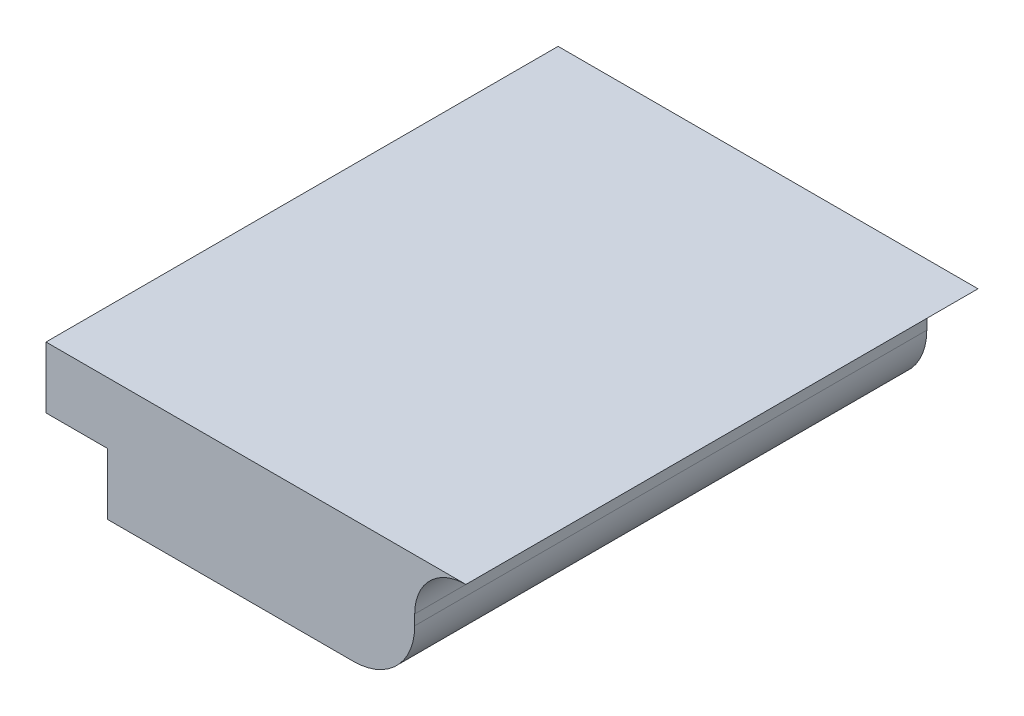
SolidWorks part; units mm, degrees
ref_plane "Plane1" through (0, 0, 0) normal (0, 0, 1) x (1, 0, 0)
ref_plane "Plane2" through (0, 0, 0) normal (0, 1, 0) x (1, 0, 0)
ref_plane "Plane3" through (0, 0, 0) normal (1, 0, 0) x (0, 0, -1)
sketch "Sketch1" plane through (0, 0, 0) normal (0, 0, 1) x (1, 0, 0)
  line L0 (-25, 5) -> (25, 5)
  line L1 (-25, 5) -> (-25, 0)
  line L2 (25, 0) -> (-25, 0)
  line L3 (25, 0) -> (25, 5)
  line L4 (0, 5) -> (0, 0) construction
  line L5 (50, 0) -> (-50, 0) construction
  dimension "D1" = 50
  dimension "D2" = 5
extrude "Base-Extrude" add sketch "Sketch1" along normal mid plane 50
sketch "Lance Tool sketch" plane through (0, 0, 0) normal (0, 0, 1) x (1, 0, 0)
  line L0 (9, 0) -> (-9, 0)
  line L1 (9, 0) -> (9, -6)
  line L2 (9, -6) -> (-6, -6)
  line L3 (-6, -6) -> (-6, -3)
  line L4 (0, 0) -> (0, -6) construction
  line L5 (25, 0) -> (-25, 0) construction
  line L6 (-6, -3) -> (-9, -3)
  line L7 (-9, -3) -> (-9, 0)
  dimension "D1" = 3
  dimension "Height from Drop Face" = 6
  dimension "Opening Width" = 18
  dimension "Form Width" = 15
extrude "Lance Tool" add sketch "Lance Tool sketch" along normal mid plane 25
fillet "Inside Fillet" radius 2.5 1 edges at (9, 0, 0)
fillet "Round" radius 3 1 edges at (9, -6, 0)
sketch "Sketch3" plane through (25, 0, 0) normal (1, 0, 0) x (0, 0, -1)
  line L4 (25, 5) -> (-25, 5)
  line L5 (-25, 5) -> (-25, 0)
  line L6 (-25, 0) -> (25, 0)
  line L7 (25, 0) -> (25, 5)
  line L8 (25, 5) -> (-25, 5)
  line L9 (-25, 5) -> (-25, 0)
  line L10 (-25, 0) -> (25, 0)
  line L11 (25, 0) -> (25, 5)
  dimension "D1" = 0
extrude "Cut-Extrude1" cut sketch "Sketch3" against normal through all
sketch "Orientation sketch" plane through (0, 0, 0) normal (0, 1, 0) x (-1, 0, 0)
  line L4 (9, -12.5) -> (9, 12.5)
  line L5 (9, 12.5) -> (-11.5, 12.5)
  line L6 (-11.5, 12.5) -> (-11.5, -12.5)
  line L7 (-11.5, -12.5) -> (9, -12.5)
  line L8 (9, -12.5) -> (9, 12.5)
  line L9 (9, 12.5) -> (-11.5, 12.5)
  line L10 (-11.5, 12.5) -> (-11.5, -12.5)
  line L11 (-11.5, -12.5) -> (9, -12.5)
  dimension "D1" = 0
